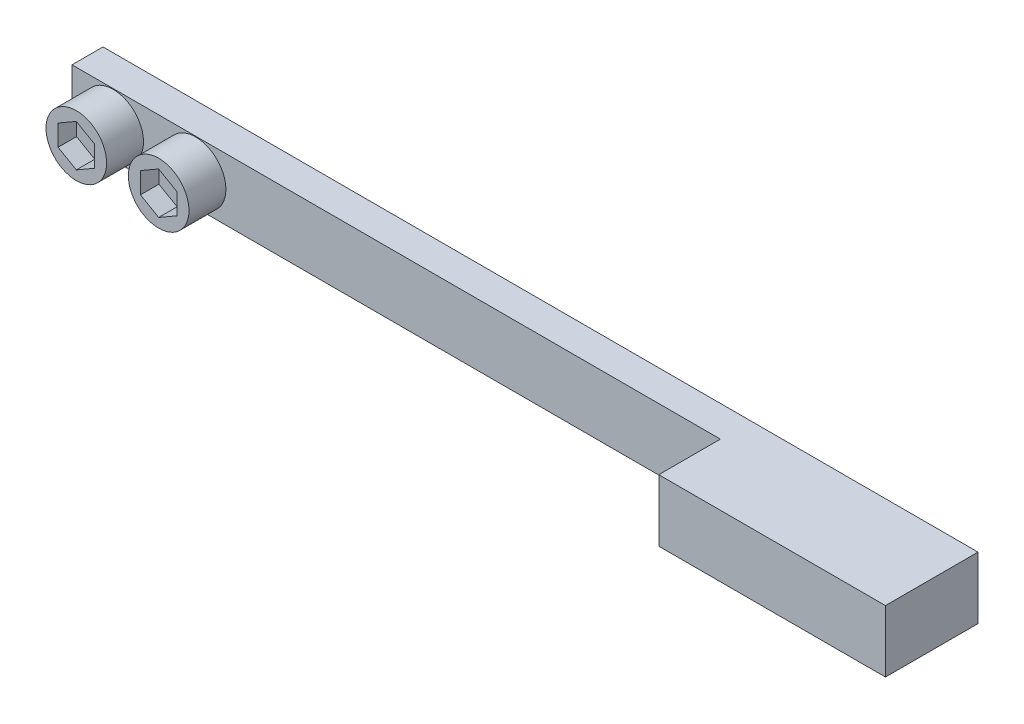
SolidWorks part; units mm, degrees
ref_plane "Front Plane" through (0, 0, 0) normal (0, 0, 1) x (1, 0, 0)
ref_plane "Top Plane" through (0, 0, 0) normal (0, 1, 0) x (1, 0, 0)
ref_plane "Right Plane" through (0, 0, 0) normal (1, 0, 0) x (0, 0, -1)
ref_plane "Plane1" through (-33.7312, 0, 0) normal (1, 0, 0) x (0, 0, -1)
ref_plane "Plane2" through (0, 0, -1.1938) normal (0, 0, 1) x (1, 0, 0)
ref_plane "Plane3" through (0, -2.3876, 0) normal (0, 1, 0) x (-1, 0, 0)
sketch "Sketch1" plane through (0, -2.3876, 0) normal (0, 1, 0) x (-1, 0, 0)
  line L0 (33.7312, -1.1938) -> (33.7312, 1.1938)
  line L1 (33.7312, 1.1938) -> (-16.256, 1.1938)
  line L2 (-16.256, 1.1938) -> (-16.256, 5.9436)
  line L3 (-16.256, 5.9436) -> (-33.7312, 5.9436)
  line L4 (-33.7312, 5.9436) -> (-33.7312, -1.1938)
  line L5 (-33.7312, -1.1938) -> (33.7312, -1.1938)
extrude "Extrude1" add sketch "Sketch1" along normal blind 4.7752
ref_plane "Plane4" through (0, 0, 1.1938) normal (0, 0, 1) x (1, 0, 0)
sketch "Sketch2" plane through (0, 0, 1.1938) normal (0, 0, 1) x (1, 0, 0)
  circle A0 centre (-30.5562, 0) radius 2.3368
extrude "Extrude2" add sketch "Sketch2" along normal blind 2.8448
ref_plane "Plane5" through (0, 0, 4.0386) normal (0, 0, 1) x (1, 0, 0)
sketch "Sketch3" plane through (0, 0, 4.0386) normal (0, 0, 1) x (1, 0, 0)
  line L0 (-31.9583, 0.8095) -> (-31.9583, -0.8095)
  line L1 (-31.9583, -0.8095) -> (-30.5562, -1.619)
  line L2 (-30.5562, -1.619) -> (-29.1541, -0.8095)
  line L3 (-29.1541, -0.8095) -> (-29.1541, 0.8095)
  line L4 (-29.1541, 0.8095) -> (-30.5562, 1.619)
  line L5 (-30.5562, 1.619) -> (-31.9583, 0.8095)
extrude "Cut-Extrude1" cut sketch "Sketch3" against normal blind 1.4224
sketch "Sketch4" plane through (0, 0, 1.1938) normal (0, 0, 1) x (1, 0, 0)
  circle A0 centre (-24.2062, 0) radius 2.3368
sketch "Sketch5" plane through (0, 0, 4.0386) normal (0, 0, 1) x (1, 0, 0)
  line L0 (-25.6083, 0.8095) -> (-25.6083, -0.8095)
  line L1 (-25.6083, -0.8095) -> (-24.2062, -1.619)
  line L2 (-24.2062, -1.619) -> (-22.8041, -0.8095)
  line L3 (-22.8041, -0.8095) -> (-22.8041, 0.8095)
  line L4 (-22.8041, 0.8095) -> (-24.2062, 1.619)
  line L5 (-24.2062, 1.619) -> (-25.6083, 0.8095)
extrude "Extrude3" add sketch "Sketch4" along normal blind 2.8448
extrude "Cut-Extrude2" cut sketch "Sketch5" against normal blind 1.4224
ref_plane "Plane6" through (-20.5486, 0, 0) normal (-1, 0, 0) x (0, 0, 1)
